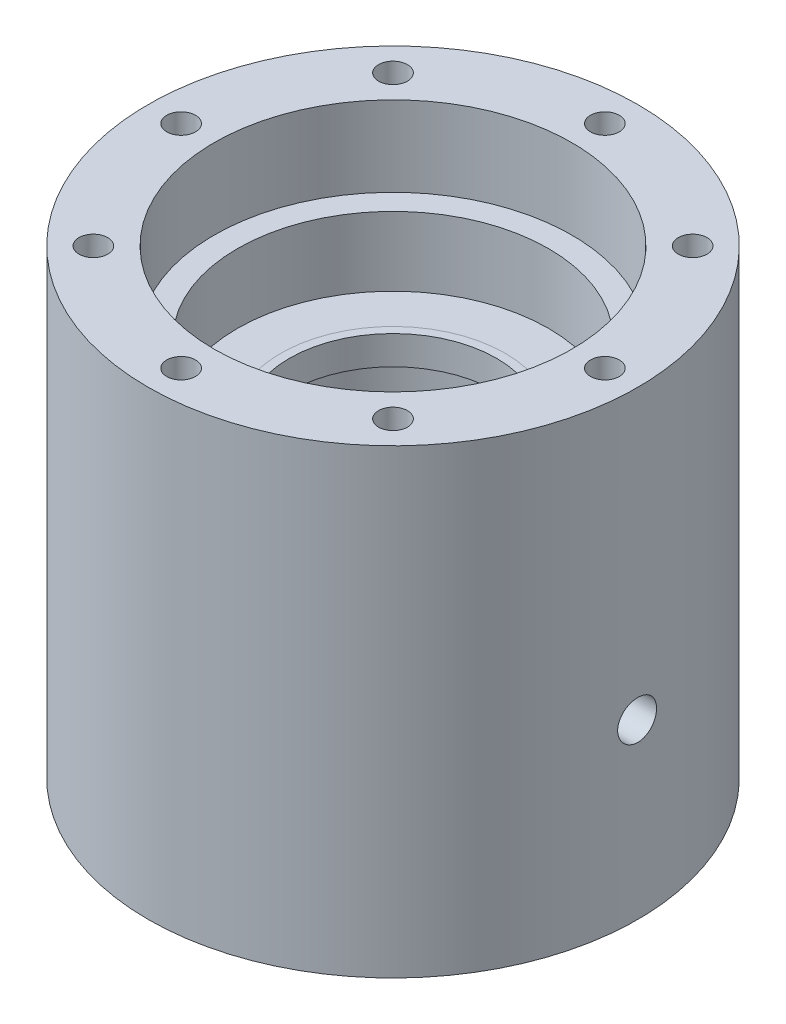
SolidWorks part; units mm, degrees
ref_plane "Piano frontale" through (0, 0, 0) normal (0, 0, 1) x (1, 0, 0)
ref_plane "Piano superiore" through (0, 0, 0) normal (0, 1, 0) x (1, 0, 0)
ref_plane "Piano destro" through (0, 0, 0) normal (1, 0, 0) x (0, 0, -1)
sketch "Schizzo1" plane through (0, 0, 0) normal (0, 1, 0) x (1, 0, 0)
  circle A0 centre (0, 0) radius 42.5
  circle A1 centre (0, 0) radius 19.5
  dimension "D1" = 39
  dimension "D2" = 85
extrude "Estrusione-Estrusione1" add sketch "Schizzo1" along normal blind 80
sketch "Schizzo4" plane through (0, 80, 0) normal (0, 1, 0) x (1, 0, 0)
  circle A0 centre (0, 0) radius 31.05
  dimension "D1" = 62.1
extrude "Taglio-Estrusione1" cut sketch "Schizzo4" against normal blind 13.9
sketch "Schizzo5" plane through (0, 66.1, 0) normal (0, 1, 0) x (1, 0, 0)
  circle A0 centre (0, 0) radius 27
  dimension "D1" = 54
extrude "Taglio-Estrusione2" cut sketch "Schizzo5" against normal blind 12
hole_wizard "Foro Ø5.0 (5)-1" positions "Schizzo2" profile "Schizzo3" hole size "Ø5.0" standard "ISO"
sketch "Schizzo2" plane through (0, 80, 0) normal (0, 1, 0) x (1, 0, 0)
  line L2 (0, 0) -> (-31.05, 0) construction
  line L4 (0, 0) -> (-26.0039, 26.0039) construction
  line L6 (0, 0) -> (26.0039, -26.0039) construction
  line L9 (0, 0) -> (-26.0039, -26.0039) construction
  line L11 (0, 0) -> (26.0039, 26.0039) construction
  line L12 (-31.05, 0) -> (-36.775, 0) construction
  line L13 (-36.775, 0) -> (-42.5, 0) construction
  circle A0 centre (0, 0) radius 36.775 construction
  circle A3 centre (0, 0) radius 31.05 construction
  circle A4 centre (0, 0) radius 42.5 construction
  point P6 (-36.775, 0)
  point P14 (0, 36.775)
  point P16 (36.775, 0)
  point P25 (0, -36.775)
  point P35 (-26.0039, 26.0039)
  point P40 (26.0039, -26.0039)
  point P46 (-26.0039, -26.0039)
  point P51 (26.0039, 26.0039)
  dimension "D1" = 45
sketch "Schizzo3" plane through (26.0039, 80, -26.0039) normal (1, 0, 0) x (0, 0, 1)
  line L0 (0, 0) -> (0, 13.5022)
  line L1 (0, 13.5022) -> (2.5, 12)
  line L2 (2.5, 12) -> (2.5, 0)
  line L5 (2.5, 0) -> (0, 0)
  line L10 (0, 13.5022) -> (-2.5, 12) construction
  line L11 (0, -6.35) -> (0, 107.95) construction
  dimension "Hole Dia." = 5
  dimension "Hole Depth" = 12
  dimension "Drill Angle" = 118
ref_plane "Piano1" through (42.5, 0, 0) normal (1, 0, 0) x (0, 0, -1)
sketch "Schizzo6" plane through (42.5, 0, 0) normal (1, 0, 0) x (0, 0, -1)
  line L0 (0, 0) -> (0, 30) construction
  circle A0 centre (0, 30) radius 3.375
  dimension "D1" = 6.75
  dimension "D2" = 30
extrude "Taglio-Estrusione3" cut sketch "Schizzo6" against normal up to next
sketch "Schizzo7" plane through (0, 54.1, 0) normal (0, 1, 0) x (1, 0, 0)
  circle A0 centre (0, 0) radius 19.5
  circle A1 centre (0, 0) radius 18
  dimension "D1" = 36
extrude "Estrusione-Estrusione2" add sketch "Schizzo7" against normal blind 5 separate body
